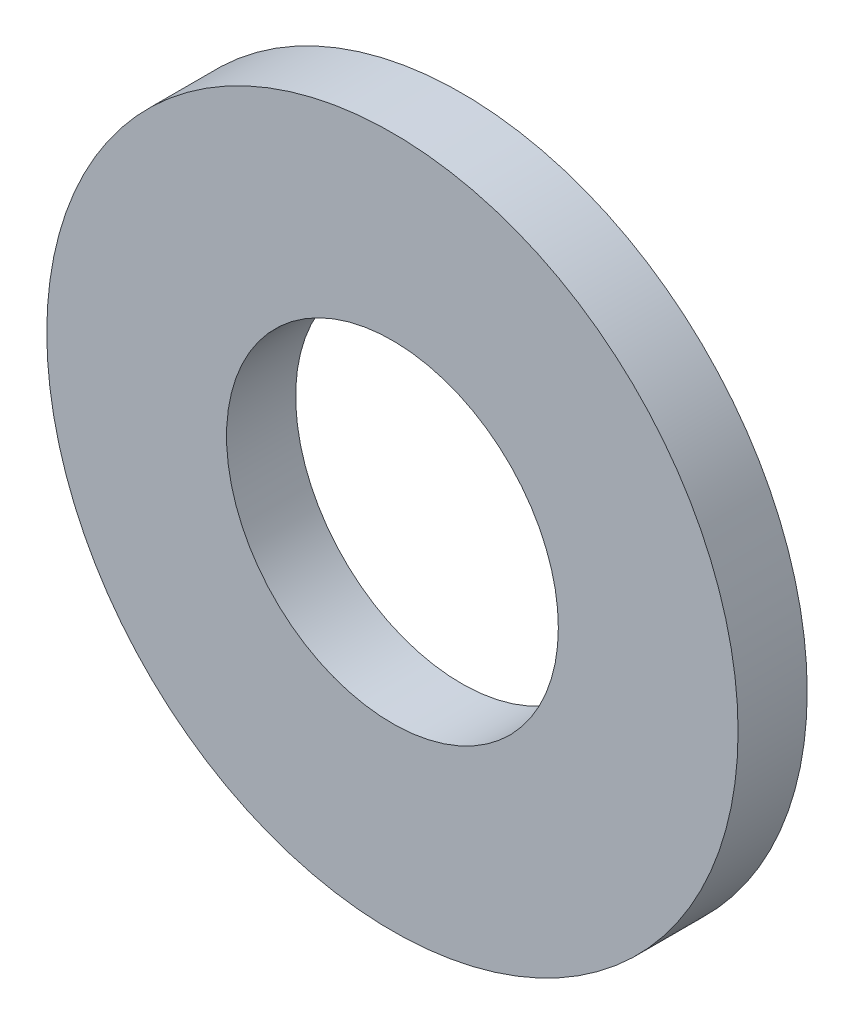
SolidWorks part; units mm, degrees
ref_plane "Plan de face" through (0, 0, 0) normal (0, 0, 1) x (1, 0, 0)
ref_plane "Plan de dessus" through (0, 0, 0) normal (0, 1, 0) x (1, 0, 0)
ref_plane "Plan de droite" through (0, 0, 0) normal (1, 0, 0) x (0, 0, -1)
sketch "Esquisse1" plane through (0, 0, 0) normal (0, 0, 1) x (1, 0, 0)
  circle A0 centre (0, 0) radius 12.5
  circle A1 centre (0, 0) radius 6
  dimension "D1" = 25
  dimension "D2" = 12
extrude "Extrusion1" add sketch "Esquisse1" along normal blind 2.5
